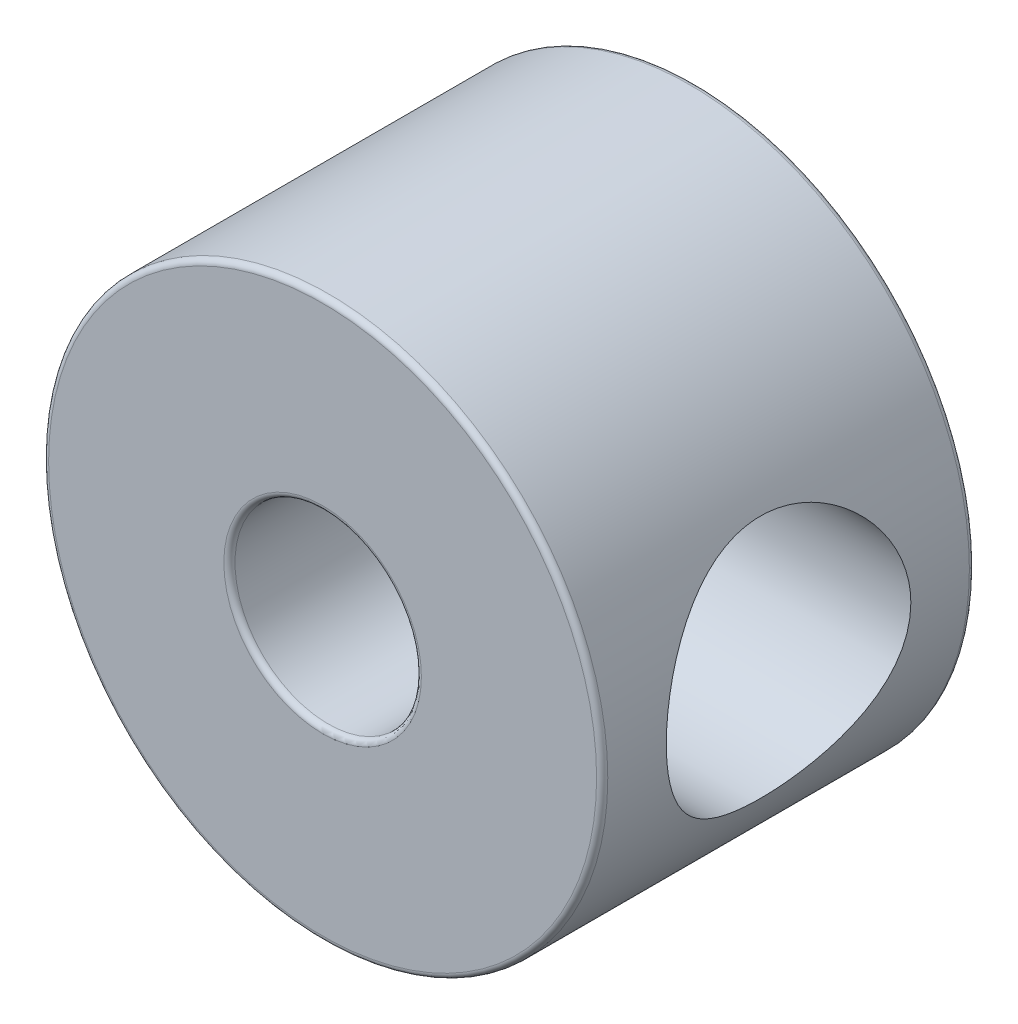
SolidWorks part; units mm, degrees
ref_plane "Front Plane" through (0, 0, 0) normal (0, 0, 1) x (1, 0, 0)
ref_plane "Top Plane" through (0, 0, 0) normal (0, 1, 0) x (1, 0, 0)
ref_plane "Right Plane" through (0, 0, 0) normal (1, 0, 0) x (0, 0, -1)
sketch "Sketch1" plane through (0, 0, 0) normal (0, 0, 1) x (1, 0, 0)
  circle A0 centre (0, 0) radius 4.7625
  circle A1 centre (0, 0) radius 1.5875
  point P4 (4.7625, 0)
extrude "Extrude1" add sketch "Sketch1" along normal blind 6.35
ref_plane "Plane1" through (4.7625, 0, 0) normal (1, 0, 0) x (0, 0, -1)
sketch "Sketch2" plane through (4.7625, 0, 0) normal (1, 0, 0) x (0, 0, -1)
  line L0 (0, 0) -> (-6.35, 0) construction
  line L1 (-6.35, 4.7625) -> (-6.35, -4.7625) construction
  circle A0 centre (-3.175, 0) radius 2.0828
extrude "Cut-Extrude1" cut sketch "Sketch2" against normal up to surface (4.7625 mm away)
ref_plane "Plane2" through (0, 0, 3.175) normal (0, 0, 1) x (1, 0, 0)
sketch "Sketch3" plane through (0, 0, 3.175) normal (0, 0, 1) x (1, 0, 0)
  line L1 (2.3813, 0) -> (5.5562, 0)
  line L2 (2.3813, 0) -> (2.3813, 2.0828)
  line L3 (2.3813, 2.0828) -> (5.5562, 2.0828)
  line L4 (5.5562, 0) -> (5.5562, 2.0828)
  line L5 (2.3813, 0) -> (0, 0) construction
revolve "Revolve1" [suppressed] add sketch "Sketch3" angle 360 about L1
sketch "Sketch4" [suppressed] plane through (5.5563, 0, 0) normal (1, 0, 0) x (0, 0, -1)
  line L1 (-3.175, 1.0823) -> (-4.1123, 0.5411)
  line L2 (-4.1123, 0.5411) -> (-4.1123, -0.5411)
  line L3 (-4.1123, -0.5411) -> (-3.175, -1.0823)
  line L4 (-3.175, -1.0823) -> (-2.2377, -0.5411)
  line L5 (-2.2377, -0.5411) -> (-2.2377, 0.5411)
  line L6 (-2.2377, 0.5411) -> (-3.175, 1.0823)
  circle A0 centre (-3.175, 0) radius 0.9373 construction
extrude "Cut-Extrude2" [suppressed] cut sketch "Sketch4" against normal up to vertex
fillet "Fillet1" radius 0.0953 4 edges at (1.5875, 0, 0) (1.5875, 0, 6.35) (4.7625, 0, 0) (4.7625, 0, 6.35)
equation "\"D1@Sketch3\" = (\"OD@Sketch1\"-\"Bore Dia@Sketch1\")/2"
equation "\"D2@Sketch3\" = \"D1@Sketch3\"/4"
equation "\"D1@Sketch4\" = \"Set Screw Dia@Sketch2\"*.45"
equation "\"D3@Sketch3\" = \"Set Screw Dia@Sketch2\""
equation "\"D1@Fillet1\" = \"OD@Sketch1\"*.01"
